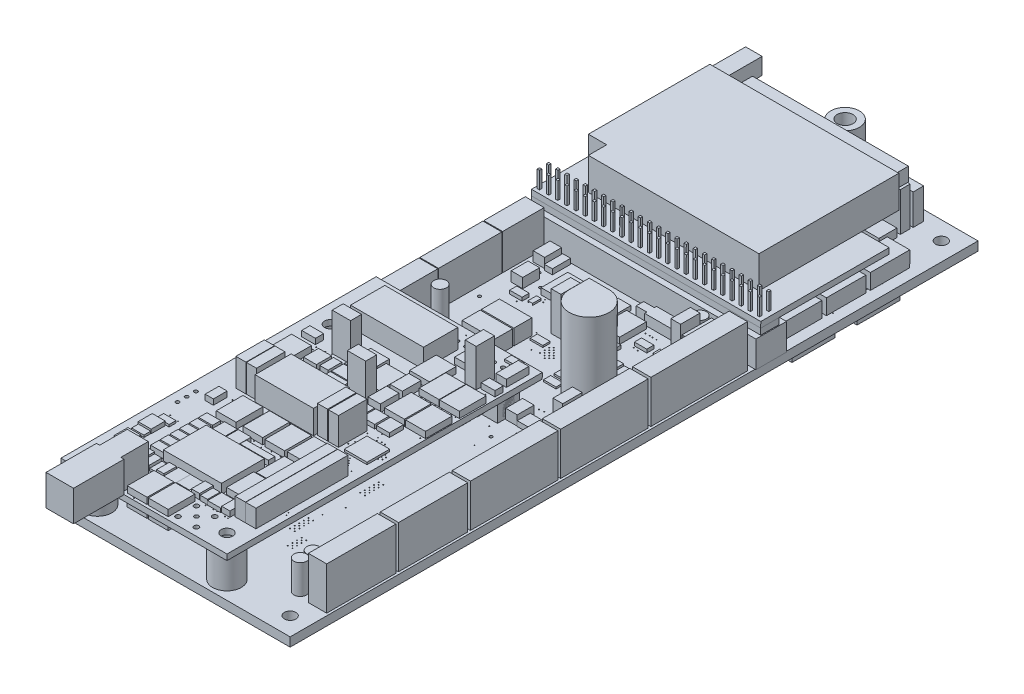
SolidWorks part; units mm, degrees
ref_plane "Front Plane" through (0, 0, 0) normal (0, 0, 1) x (1, 0, 0)
ref_plane "Top Plane" through (0, 0, 0) normal (0, 1, 0) x (1, 0, 0)
ref_plane "Right Plane" through (0, 0, 0) normal (1, 0, 0) x (0, 0, -1)
imported_body "CF2-1-solid1"
imported_body "PCB-pH2-10020553rc_SOLID-1-solid1"
imported_body "PCB-pH2-10020553rc_SOLID-1-surface1"
imported_body "PCB-pH2-10020553rc_SOLID-1-surface2"
imported_body "PCB-pH2-10020553rc_SOLID-1-surface3"
imported_body "PCB-pH2-10020553rc_SOLID-1-surface5"
imported_body "PCB-pH2-10020553rc_SOLID-1-surface6"
imported_body "PCB-pH2-10020553rc_SOLID-1-surface7"
imported_body "PCB-pH2-10020553rc_SOLID-1-surface8"
imported_body "PCB-pH2-10020553rc_SOLID-1-surface9"
imported_body "PCB-pH2-10020553rc_SOLID-1-surface10"
imported_body "PCB-pH2-10020553rc_SOLID-1-surface11"
imported_body "PCB-pH2-10020553rc_SOLID-1-surface12"
imported_body "PCB-pH2-10020553rc_SOLID-1-surface13"
imported_body "PCB-pH2-10020553rc_SOLID-1-surface14"
imported_body "PCB-pH2-10020553rc_SOLID-1-surface15"
imported_body "PCB-pH2-10020553rc_SOLID-1-surface16"
imported_body "PCB-pH2-10020553rc_SOLID-1-surface17"
imported_body "PCB-pH2-10020553rc_SOLID-1-surface18"
imported_body "PCB-pH2-10020553rc_SOLID-1-surface19"
imported_body "PCB-pH2-10020553rc_SOLID-1-surface20"
imported_body "PCB-pH2-10020553rc_SOLID-1-surface21"
imported_body "PCB-pH2-10020553rc_SOLID-1-surface22"
imported_body "PCB-pH2-10020553rc_SOLID-1-surface23"
imported_body "PCB-pH2-10020553rc_SOLID-1-surface24"
imported_body "PCB-pH2-10020553rc_SOLID-1-surface25"
imported_body "PCB-pH2-10020553rc_SOLID-1-surface26"
imported_body "PCB-pH2-10020553rc_SOLID-1-surface27"
imported_body "PCB-pH2-10020553rc_SOLID-1-surface28"
imported_body "PCB-pH2-10020553rc_SOLID-1-surface29"
imported_body "PCB-pH2-10020553rc_SOLID-1-surface30"
imported_body "PCB-pH2-10020553rc_SOLID-1-surface31"
imported_body "PCB-pH2-10020553rc_SOLID-1-surface32"
imported_body "PCB-pH2-10020553rc_SOLID-1-surface33"
imported_body "PCB-pH2-10020553rc_SOLID-1-surface34"
imported_body "PCB-pH2-10020553rc_SOLID-1-surface35"
imported_body "PCB-pH2-10020553rc_SOLID-1-surface36"
imported_body "PCB-pH2-10020553rc_SOLID-1-surface37"
imported_body "PCB-pH2-10020553rc_SOLID-1-surface38"
imported_body "PCB-pH2-10020553rc_SOLID-1-surface39"
imported_body "PCB-pH2-10020553rc_SOLID-1-surface40"
imported_body "PCB-pH2-10020553rc_SOLID-1-surface41"
imported_body "PCB-pH2-10020553rc_SOLID-1-surface42"
imported_body "PCB-pH2-10020553rc_SOLID-1-surface43"
imported_body "PCB-pH2-10020553rc_SOLID-1-surface44"
imported_body "PCB-pH2-10020553rc_SOLID-1-surface45"
imported_body "PCB-pH2-10020553rc_SOLID-1-surface46"
imported_body "PCB-pH2-10020553rc_SOLID-1-surface47"
imported_body "PCB-pH2-10020553rc_SOLID-1-surface48"
imported_body "PCB-pH2-10020553rc_SOLID-1-surface49"
imported_body "PCB-pH2-10020553rc_SOLID-1-surface50"
imported_body "PCB-pH2-10020553rc_SOLID-1-surface51"
imported_body "PCB-pH2-10020553rc_SOLID-1-surface52"
imported_body "PCB-pH2-10020553rc_SOLID-1-surface53"
imported_body "PCB-pH2-10020553rc_SOLID-1-surface54"
imported_body "PCB-pH2-10020553rc_SOLID-1-surface55"
imported_body "PCB-pH2-10020553rc_SOLID-1-surface56"
imported_body "PCB-pH2-10020553rc_SOLID-1-surface57"
imported_body "PCB-pH2-10020553rc_SOLID-1-surface58"
imported_body "PCB-pH2-10020553rc_SOLID-1-surface59"
imported_body "PCB-pH2-10020553rc_SOLID-1-surface60"
imported_body "PCB-pH2-10020553rc_SOLID-1-surface61"
imported_body "PCB-pH2-10020553rc_SOLID-1-surface62"
imported_body "PCB-pH2-10020553rc_SOLID-1-surface63"
imported_body "PCB-pH2-10020553rc_SOLID-1-surface64"
imported_body "PCB-pH2-10020553rc_SOLID-1-surface65"
imported_body "PCB-pH2-10020553rc_SOLID-1-surface66"
imported_body "PCB-pH2-10020553rc_SOLID-1-surface67"
imported_body "PCB-pH2-10020553rc_SOLID-1-surface68"
imported_body "PCB-pH2-10020553rc_SOLID-1-surface69"
imported_body "PCB-pH2-10020553rc_SOLID-1-surface70"
imported_body "PCB-pH2-10020553rc_SOLID-1-surface71"
imported_body "PCB-pH2-10020553rc_SOLID-1-surface72"
imported_body "PCB-pH2-10020553rc_SOLID-1-surface73"
imported_body "PCB-pH2-10020553rc_SOLID-1-surface74"
imported_body "PCB-pH2-10020553rc_SOLID-1-surface75"
imported_body "PCB-pH2-10020553rc_SOLID-1-surface76"
imported_body "PCB-pH2-10020553rc_SOLID-1-surface77"
imported_body "PCB-pH2-10020553rc_SOLID-1-surface78"
imported_body "PCB-pH2-10020553rc_SOLID-1-surface79"
imported_body "PCB-pH2-10020553rc_SOLID-1-surface80"
imported_body "PCB-pH2-10020553rc_SOLID-1-surface81"
imported_body "PCB-pH2-10020553rc_SOLID-1-surface82"
imported_body "PCB-pH2-10020553rc_SOLID-1-surface83"
imported_body "PCB-pH2-10020553rc_SOLID-1-surface84"
imported_body "PCB-pH2-10020553rc_SOLID-1-surface85"
imported_body "PCB-pH2-10020553rc_SOLID-1-surface86"
imported_body "PCB-pH2-10020553rc_SOLID-1-surface87"
imported_body "PCB-pH2-10020553rc_SOLID-1-surface88"
imported_body "PCB-pH2-10020553rc_SOLID-1-surface89"
imported_body "PCB-pH2-10020553rc_SOLID-1-surface90"
imported_body "PCB-pH2-10020553rc_SOLID-1-surface91"
imported_body "PCB-pH2-10020553rc_SOLID-1-surface92"
imported_body "PCB-pH2-10020553rc_SOLID-1-surface93"
imported_body "PCB-pH2-10020553rc_SOLID-1-surface94"
imported_body "PCB-pH2-10020553rc_SOLID-1-surface95"
imported_body "PCB-pH2-10020553rc_SOLID-1-surface96"
imported_body "PCB-pH2-10020553rc_SOLID-1-surface97"
imported_body "PCB-pH2-10020553rc_SOLID-1-surface98"
imported_body "PCB-pH2-10020553rc_SOLID-1-surface99"
imported_body "PCB-pH2-10020553rc_SOLID-1-surface100"
imported_body "PCB-pH2-10020553rc_SOLID-1-surface101"
imported_body "PCB-pH2-10020553rc_SOLID-1-surface102"
imported_body "PCB-pH2-10020553rc_SOLID-1-surface103"
imported_body "PCB-pH2-10020553rc_SOLID-1-surface104"
imported_body "PCB-pH2-10020553rc_SOLID-1-surface105"
imported_body "PCB-pH2-10020553rc_SOLID-1-surface106"
imported_body "PCB-pH2-10020553rc_SOLID-1-surface107"
imported_body "PCB-pH2-10020553rc_SOLID-1-surface108"
imported_body "PCB-pH2-10020553rc_SOLID-1-surface109"
imported_body "PCB-pH2-10020553rc_SOLID-1-surface110"
imported_body "PCB-pH2-10020553rc_SOLID-1-surface111"
imported_body "PCB-pH2-10020553rc_SOLID-1-surface112"
imported_body "PCB-pH2-10020553rc_SOLID-1-surface113"
imported_body "PCB-pH2-10020553rc_SOLID-1-surface114"
imported_body "PCB-pH2-10020553rc_SOLID-1-surface115"
imported_body "PCB-pH2-10020553rc_SOLID-1-surface116"
imported_body "PCB-pH2-10020553rc_SOLID-1-surface117"
imported_body "PCB-pH2-10020553rc_SOLID-1-surface118"
imported_body "PCB-pH2-10020553rc_SOLID-1-surface119"
imported_body "PCB-pH2-10020553rc_SOLID-1-surface120"
imported_body "PCB-pH2-10020553rc_SOLID-1-surface121"
imported_body "PCB-pH2-10020553rc_SOLID-1-surface122"
imported_body "PCB-pH2-10020553rc_SOLID-1-surface123"
imported_body "PCB-pH2-10020553rc_SOLID-1-surface124"
imported_body "PCB-pH2-10020553rc_SOLID-1-surface125"
imported_body "PCB-pH2-10020553rc_SOLID-1-surface126"
imported_body "PCB-pH2-10020553rc_SOLID-1-surface127"
imported_body "PCB-pH2-10020553rc_SOLID-1-surface128"
imported_body "PCB-pH2-10020553rc_SOLID-1-surface129"
imported_body "PCB-pH2-10020553rc_SOLID-1-surface130"
imported_body "PCB-pH2-10020553rc_SOLID-1-surface131"
imported_body "PCB-pH2-10020553rc_SOLID-1-surface132"
imported_body "PCB-pH2-10020553rc_SOLID-1-surface133"
imported_body "PCB-pH2-10020553rc_SOLID-1-surface134"
imported_body "PCB-pH2-10020553rc_SOLID-1-surface135"
imported_body "PCB-pH2-10020553rc_SOLID-1-surface136"
imported_body "PCB-pH2-10020553rc_SOLID-1-surface137"
imported_body "PCB-pH2-10020553rc_SOLID-1-surface138"
imported_body "PCB-pH2-10020553rc_SOLID-1-surface139"
imported_body "PCB-pH2-10020553rc_SOLID-1-surface140"
imported_body "PCB-pH2-10020553rc_SOLID-1-surface141"
imported_body "PCB-pH2-10020553rc_SOLID-1-surface142"
imported_body "PCB-pH2-10020553rc_SOLID-1-surface143"
imported_body "PCB-pH2-10020553rc_SOLID-1-surface144"
imported_body "PCB-pH2-10020553rc_SOLID-1-surface145"
imported_body "PCB-pH2-10020553rc_SOLID-1-surface146"
imported_body "PCB-pH2-10020553rc_SOLID-1-surface147"
imported_body "PCB-pH2-10020553rc_SOLID-1-surface148"
imported_body "PCB-pH2-10020553rc_SOLID-1-surface149"
imported_body "PCB-pH2-10020553rc_SOLID-1-surface150"
imported_body "PCB-pH2-10020553rc_SOLID-1-surface151"
imported_body "PCB-pH2-10020553rc_SOLID-1-surface152"
imported_body "PCB-pH2-10020553rc_SOLID-1-surface153"
imported_body "PCB-pH2-10020553rc_SOLID-1-surface154"
imported_body "PCB-pH2-10020553rc_SOLID-1-surface155"
imported_body "PCB-pH2-10020553rc_SOLID-1-surface156"
imported_body "PCB-pH2-10020553rc_SOLID-1-surface157"
imported_body "PCB-pH2-10020553rc_SOLID-1-surface158"
imported_body "PCB-pH2-10020553rc_SOLID-1-surface159"
imported_body "PCB-pH2-10020553rc_SOLID-1-surface160"
imported_body "PCB-pH2-10020553rc_SOLID-1-surface161"
imported_body "PCB-pH2-10020553rc_SOLID-1-surface162"
imported_body "PCB-pH2-10020553rc_SOLID-1-surface163"
imported_body "PCB-pH2-10020553rc_SOLID-1-surface164"
imported_body "PCB-pH2-10020553rc_SOLID-1-surface165"
imported_body "PCB-pH2-10020553rc_SOLID-1-surface166"
imported_body "PCB-pH2-10020553rc_SOLID-1-surface167"
imported_body "PCB-pH2-10020553rc_SOLID-1-surface168"
imported_body "PCB-pH2-10020553rc_SOLID-1-surface169"
imported_body "PCB-pH2-10020553rc_SOLID-1-surface170"
imported_body "PCB-pH2-10020553rc_SOLID-1-surface171"
imported_body "PCB-pH2-10020553rc_SOLID-1-surface172"
imported_body "PCB-pH2-10020553rc_SOLID-1-surface173"
imported_body "PCB-pH2-10020553rc_SOLID-1-surface174"
imported_body "PCB-pH2-10020553rc_SOLID-1-surface175"
imported_body "PCB-Cont2-10021035rb_SOLID_093-1-surface1"
ref_plane "Plane1" through (31.757, 0.0134, 0) normal (-1, -0.0004, 0) x (0, 0, 1)
imported_body "PCB-Cont2-10021035rb_SOLID_093-1-surface2"
imported_body "PCB-Cont2-10021035rb_SOLID_093-1-surface3"
imported_body "PCB-Cont2-10021035rb_SOLID_093-1-surface4"
imported_body "PCB-Cont2-10021035rb_SOLID_093-1-surface5"
imported_body "PCB-Cont2-10021035rb_SOLID_093-1-surface6"
imported_body "PCB-Cont2-10021035rb_SOLID_093-1-surface7"
imported_body "PCB-Cont2-10021035rb_SOLID_093-1-surface8"
imported_body "PCB-Cont2-10021035rb_SOLID_093-1-surface9"
imported_body "PCB-Cont2-10021035rb_SOLID_093-1-surface10"
imported_body "PCB-Cont2-10021035rb_SOLID_093-1-surface11"
imported_body "PCB-Cont2-10021035rb_SOLID_093-1-surface12"
imported_body "PCB-Cont2-10021035rb_SOLID_093-1-surface13"
imported_body "PCB-Cont2-10021035rb_SOLID_093-1-surface14"
imported_body "PCB-Cont2-10021035rb_SOLID_093-1-surface15"
imported_body "PCB-Cont2-10021035rb_SOLID_093-1-surface16"
imported_body "PCB-Cont2-10021035rb_SOLID_093-1-surface17"
imported_body "PCB-Cont2-10021035rb_SOLID_093-1-surface18"
imported_body "PCB-Cont2-10021035rb_SOLID_093-1-surface19"
imported_body "PCB-Cont2-10021035rb_SOLID_093-1-surface20"
imported_body "PCB-Cont2-10021035rb_SOLID_093-1-surface21"
imported_body "PCB-Cont2-10021035rb_SOLID_093-1-surface22"
imported_body "PCB-Cont2-10021035rb_SOLID_093-1-surface23"
imported_body "PCB-Cont2-10021035rb_SOLID_093-1-surface24"
imported_body "PCB-Cont2-10021035rb_SOLID_093-1-surface25"
imported_body "PCB-Cont2-10021035rb_SOLID_093-1-surface26"
imported_body "PCB-Cont2-10021035rb_SOLID_093-1-surface27"
imported_body "PCB-Cont2-10021035rb_SOLID_093-1-surface28"
imported_body "PCB-Cont2-10021035rb_SOLID_093-1-surface29"
imported_body "PCB-Cont2-10021035rb_SOLID_093-1-surface30"
imported_body "PCB-Cont2-10021035rb_SOLID_093-1-surface31"
imported_body "PCB-Cont2-10021035rb_SOLID_093-1-surface32"
imported_body "PCB-Cont2-10021035rb_SOLID_093-1-surface33"
imported_body "PCB-Cont2-10021035rb_SOLID_093-1-surface34"
imported_body "PCB-Cont2-10021035rb_SOLID_093-1-surface35"
imported_body "PCB-Cont2-10021035rb_SOLID_093-1-surface36"
imported_body "PCB-Cont2-10021035rb_SOLID_093-1-surface37"
imported_body "PCB-Cont2-10021035rb_SOLID_093-1-surface38"
imported_body "PCB-Cont2-10021035rb_SOLID_093-1-surface39"
imported_body "PCB-Cont2-10021035rb_SOLID_093-1-surface40"
imported_body "PCB-Cont2-10021035rb_SOLID_093-1-surface41"
imported_body "PCB-Cont2-10021035rb_SOLID_093-1-surface42"
imported_body "PCB-Cont2-10021035rb_SOLID_093-1-surface43"
imported_body "PCB-Cont2-10021035rb_SOLID_093-1-surface44"
imported_body "PCB-Cont2-10021035rb_SOLID_093-1-surface45"
imported_body "PCB-Cont2-10021035rb_SOLID_093-1-surface46"
imported_body "PCB-Cont2-10021035rb_SOLID_093-1-surface47"
imported_body "PCB-Cont2-10021035rb_SOLID_093-1-surface48"
imported_body "PCB-Cont2-10021035rb_SOLID_093-1-surface49"
imported_body "PCB-Cont2-10021035rb_SOLID_093-1-surface50"
imported_body "PCB-Cont2-10021035rb_SOLID_093-1-surface51"
imported_body "PCB-Cont2-10021035rb_SOLID_093-1-surface52"
imported_body "PCB-Cont2-10021035rb_SOLID_093-1-surface53"
imported_body "PCB-Cont2-10021035rb_SOLID_093-1-surface54"
imported_body "PCB-Cont2-10021035rb_SOLID_093-1-surface55"
imported_body "PCB-Cont2-10021035rb_SOLID_093-1-surface56"
imported_body "PCB-Cont2-10021035rb_SOLID_093-1-surface57"
imported_body "PCB-Cont2-10021035rb_SOLID_093-1-surface58"
imported_body "PCB-Cont2-10021035rb_SOLID_093-1-surface59"
imported_body "PCB-Cont2-10021035rb_SOLID_093-1-surface60"
imported_body "PCB-Cont2-10021035rb_SOLID_093-1-surface61"
imported_body "PCB-Cont2-10021035rb_SOLID_093-1-surface62"
imported_body "PCB-Cont2-10021035rb_SOLID_093-1-surface63"
imported_body "PCB-Cont2-10021035rb_SOLID_093-1-surface64"
imported_body "PCB-Cont2-10021035rb_SOLID_093-1-surface65"
imported_body "PCB-Cont2-10021035rb_SOLID_093-1-surface66"
imported_body "PCB-Cont2-10021035rb_SOLID_093-1-surface67"
imported_body "PCB-Cont2-10021035rb_SOLID_093-1-surface68"
imported_body "PCB-Cont2-10021035rb_SOLID_093-1-surface69"
imported_body "PCB-Cont2-10021035rb_SOLID_093-1-surface70"
imported_body "PCB-Cont2-10021035rb_SOLID_093-1-surface71"
imported_body "PCB-Cont2-10021035rb_SOLID_093-1-surface72"
imported_body "PCB-Cont2-10021035rb_SOLID_093-1-surface73"
imported_body "PCB-Cont2-10021035rb_SOLID_093-1-surface74"
imported_body "PCB-Cont2-10021035rb_SOLID_093-1-surface75"
imported_body "PCB-Cont2-10021035rb_SOLID_093-1-surface76"
imported_body "PCB-Cont2-10021035rb_SOLID_093-1-surface77"
imported_body "PCB-Cont2-10021035rb_SOLID_093-1-surface78"
imported_body "PCB-Cont2-10021035rb_SOLID_093-1-surface79"
imported_body "PCB-Cont2-10021035rb_SOLID_093-1-surface80"
imported_body "PCB-Cont2-10021035rb_SOLID_093-1-surface81"
imported_body "PCB-Cont2-10021035rb_SOLID_093-1-surface82"
imported_body "PCB-Cont2-10021035rb_SOLID_093-1-surface83"
imported_body "PCB-Cont2-10021035rb_SOLID_093-1-surface84"
imported_body "PCB-Cont2-10021035rb_SOLID_093-1-surface85"
imported_body "PCB-Cont2-10021035rb_SOLID_093-1-surface86"
imported_body "PCB-Cont2-10021035rb_SOLID_093-1-surface87"
imported_body "PCB-Cont2-10021035rb_SOLID_093-1-surface88"
imported_body "PCB-Cont2-10021035rb_SOLID_093-1-surface89"
imported_body "PCB-Cont2-10021035rb_SOLID_093-1-surface90"
imported_body "PCB-Cont2-10021035rb_SOLID_093-1-surface91"
imported_body "PCB-Cont2-10021035rb_SOLID_093-1-surface92"
imported_body "PCB-Cont2-10021035rb_SOLID_093-1-surface93"
imported_body "PCB-Cont2-10021035rb_SOLID_093-1-surface94"
imported_body "PCB-Cont2-10021035rb_SOLID_093-1-surface95"
imported_body "PCB-Cont2-10021035rb_SOLID_093-1-surface96"
imported_body "PCB-Cont2-10021035rb_SOLID_093-1-surface97"
imported_body "PCB-Cont2-10021035rb_SOLID_093-1-surface98"
imported_body "PCB-Cont2-10021035rb_SOLID_093-1-surface99"
imported_body "PCB-Cont2-10021035rb_SOLID_093-1-surface100"
imported_body "PCB-Cont2-10021035rb_SOLID_093-1-surface101"
imported_body "PCB-Cont2-10021035rb_SOLID_093-1-surface102"
imported_body "PCB-Cont2-10021035rb_SOLID_093-1-surface103"
imported_body "PCB-Cont2-10021035rb_SOLID_093-1-surface104"
imported_body "PCB-Cont2-10021035rb_SOLID_093-1-surface105"
imported_body "PCB-Cont2-10021035rb_SOLID_093-1-surface106"
imported_body "PCB-Cont2-10021035rb_SOLID_093-1-surface107"
imported_body "PCB-Cont2-10021035rb_SOLID_093-1-surface108"
imported_body "PCB-Cont2-10021035rb_SOLID_093-1-surface109"
imported_body "PCB-Cont2-10021035rb_SOLID_093-1-surface110"
imported_body "PCB-Cont2-10021035rb_SOLID_093-1-surface111"
imported_body "PCB-Cont2-10021035rb_SOLID_093-1-surface112"
imported_body "PCB-Cont2-10021035rb_SOLID_093-1-surface113"
imported_body "PCB-Cont2-10021035rb_SOLID_093-1-surface114"
imported_body "PCB-Cont2-10021035rb_SOLID_093-1-surface115"
imported_body "PCB-Cont2-10021035rb_SOLID_093-1-surface116"
imported_body "PCB-Cont2-10021035rb_SOLID_093-1-surface117"
imported_body "PCB-Cont2-10021035rb_SOLID_093-1-surface118"
imported_body "PCB-Cont2-10021035rb_SOLID_093-1-surface119"
imported_body "PCB-Cont2-10021035rb_SOLID_093-1-surface120"
imported_body "PCB-Cont2-10021035rb_SOLID_093-1-surface121"
imported_body "PCB-Cont2-10021035rb_SOLID_093-1-surface122"
imported_body "PCB-Cont2-10021035rb_SOLID_093-1-surface123"
imported_body "PCB-Cont2-10021035rb_SOLID_093-1-surface124"
imported_body "PCB-Cont2-10021035rb_SOLID_093-1-surface125"
imported_body "PCB-Cont2-10021035rb_SOLID_093-1-surface126"
imported_body "PCB-Cont2-10021035rb_SOLID_093-1-surface127"
imported_body "PCB-Cont2-10021035rb_SOLID_093-1-surface128"
imported_body "PCB-Cont2-10021035rb_SOLID_093-1-surface129"
imported_body "PCB-Cont2-10021035rb_SOLID_093-1-surface130"
imported_body "PCB-Cont2-10021035rb_SOLID_093-1-surface131"
imported_body "PCB-Cont2-10021035rb_SOLID_093-1-surface132"
imported_body "PCB-Cont2-10021035rb_SOLID_093-1-surface133"
imported_body "PCB-Cont2-10021035rb_SOLID_093-1-surface134"
imported_body "PCB-Cont2-10021035rb_SOLID_093-1-surface135"
imported_body "PCB-Cont2-10021035rb_SOLID_093-1-surface136"
imported_body "PCB-Cont2-10021035rb_SOLID_093-1-surface137"
imported_body "PCB-Cont2-10021035rb_SOLID_093-1-surface138"
imported_body "PCB-Cont2-10021035rb_SOLID_093-1-surface139"
imported_body "PCB-Cont2-10021035rb_SOLID_093-1-surface140"
imported_body "PCB-Cont2-10021035rb_SOLID_093-1-surface141"
imported_body "PCB-Cont2-10021035rb_SOLID_093-1-surface142"
imported_body "PCB-Cont2-10021035rb_SOLID_093-1-surface143"
imported_body "PCB-Cont2-10021035rb_SOLID_093-1-surface144"
imported_body "PCB-Cont2-10021035rb_SOLID_093-1-surface145"
imported_body "PCB-Cont2-10021035rb_SOLID_093-1-surface146"
imported_body "PCB-Cont2-10021035rb_SOLID_093-1-surface147"
imported_body "PCB-Cont2-10021035rb_SOLID_093-1-surface148"
imported_body "PCB-Cont2-10021035rb_SOLID_093-1-surface149"
imported_body "PCB-Cont2-10021035rb_SOLID_093-1-surface150"
imported_body "PCB-Cont2-10021035rb_SOLID_093-1-surface151"
imported_body "PCB-Cont2-10021035rb_SOLID_093-1-surface152"
imported_body "PCB-Cont2-10021035rb_SOLID_093-1-surface153"
imported_body "PCB-Cont2-10021035rb_SOLID_093-1-surface154"
imported_body "PCB-Cont2-10021035rb_SOLID_093-1-surface155"
imported_body "PCB-Cont2-10021035rb_SOLID_093-1-surface156"
imported_body "PCB-Cont2-10021035rb_SOLID_093-1-surface157"
imported_body "PCB-Cont2-10021035rb_SOLID_093-1-surface158"
imported_body "PCB-Cont2-10021035rb_SOLID_093-1-surface159"
imported_body "PCB-Cont2-10021035rb_SOLID_093-1-surface160"
imported_body "PCB-Cont2-10021035rb_SOLID_093-1-surface161"
imported_body "PCB-Cont2-10021035rb_SOLID_093-1-surface162"
imported_body "PCB-Cont2-10021035rb_SOLID_093-1-surface163"
imported_body "PCB-Cont2-10021035rb_SOLID_093-1-surface164"
imported_body "PCB-Cont2-10021035rb_SOLID_093-1-surface165"
imported_body "PCB-Cont2-10021035rb_SOLID_093-1-surface166"
imported_body "PCB-Cont2-10021035rb_SOLID_093-1-surface167"
imported_body "PCB-Cont2-10021035rb_SOLID_093-1-surface168"
imported_body "PCB-Cont2-10021035rb_SOLID_093-1-surface169"
imported_body "PCB-Cont2-10021035rb_SOLID_093-1-surface170"
imported_body "PCB-Cont2-10021035rb_SOLID_093-1-surface171"
imported_body "PCB-Cont2-10021035rb_SOLID_093-1-surface172"
imported_body "PCB-Cont2-10021035rb_SOLID_093-1-surface173"
imported_body "PCB-Cont2-10021035rb_SOLID_093-1-surface174"
imported_body "PCB-Cont2-10021035rb_SOLID_093-1-surface175"
imported_body "PCB-Cont2-10021035rb_SOLID_093-1-surface176"
imported_body "PCB-Cont2-10021035rb_SOLID_093-1-surface177"
imported_body "PCB-Cont2-10021035rb_SOLID_093-1-surface178"
imported_body "PCB-Cont2-10021035rb_SOLID_093-1-surface179"
imported_body "PCB-Cont2-10021035rb_SOLID_093-1-surface180"
imported_body "PCB-Cont2-10021035rb_SOLID_093-1-surface181"
imported_body "PCB-Cont2-10021035rb_SOLID_093-1-surface182"
imported_body "PCB-Cont2-10021035rb_SOLID_093-1-surface183"
imported_body "PCB-Cont2-10021035rb_SOLID_093-1-surface184"
imported_body "PCB-Cont2-10021035rb_SOLID_093-1-surface185"
imported_body "PCB-Cont2-10021035rb_SOLID_093-1-surface186"
imported_body "pcb-10021088ra_SOLID-1-surface4"
imported_body "pcb-10021088ra_SOLID-1-surface5"
imported_body "pcb-10021088ra_SOLID-1-surface6"
imported_body "pcb-10021088ra_SOLID-1-surface7"
imported_body "pcb-10021088ra_SOLID-1-surface9"
imported_body "pcb-10021088ra_SOLID-1-surface11"
imported_body "pcb-10021088ra_SOLID-1-surface13"
imported_body "pcb-10021088ra_SOLID-1-surface15"
imported_body "pcb-10021088ra_SOLID-1-surface16"
imported_body "pcb-10021088ra_SOLID-1-surface17"
imported_body "pcb-10021088ra_SOLID-1-surface19"
imported_body "pcb-10021088ra_SOLID-1-surface20"
imported_body "pcb-10021088ra_SOLID-1-surface21"
imported_body "pcb-10021088ra_SOLID-1-surface22"
imported_body "pcb-10021088ra_SOLID-1-surface23"
imported_body "pcb-10021088ra_SOLID-1-surface24"
imported_body "pcb-10021088ra_SOLID-1-surface25"
imported_body "pcb-10021088ra_SOLID-1-surface26"
imported_body "pcb-10021088ra_SOLID-1-surface28"
imported_body "Spacer-12-solid1"
imported_body "CPUsupportAssy-1/93090A210-1-solid1"
imported_body "CPUsupportAssy-1/93090A210-2-solid1"
imported_body "CPUsupportAssy-1/93090A210-4-solid1"
imported_body "Spacer-17-solid1"
imported_body "Pan Head Phillips (U.S.)-15-solid1"
imported_body "CF2holder-1-solid1"
imported_body "Spacer-25-solid1"
imported_body "Spacer-37-solid1"
imported_body "Spacer-38-solid1"
imported_body "Spacer-39-solid1"
imported_body "Pan Head Phillips (U.S.)-31-solid1"
imported_body "Pan Head Phillips (U.S.)-32-solid1"
imported_body "Spacer-40-solid1"
sketch "Sketch1" plane through (-0.0001, 0.3025, 204.5565) normal (0, 0.0015, 1) x (1, 0, 0)
  line L4 (13.7143, 20.6095) -> (13.7143, 16.3429) construction
  line L5 (9.9043, 20.6079) -> (17.5243, 20.6111) construction
  line L6 (9.9061, 16.3429) -> (13.7143, 16.3429) construction
  line L7 (9.9043, 20.6079) -> (9.9079, 12.0779) construction
  line L9 (9.9043, 20.6079) -> (17.5279, 20.6079)
  line L10 (9.9043, 20.6079) -> (9.9043, 12.0811)
  line L11 (9.9043, 12.0811) -> (17.5279, 12.0811)
  line L12 (17.5279, 20.6079) -> (17.5279, 12.0811)
  circle A0 centre (13.7143, 16.3429) radius 3.3614
extrude "Cut-Extrude1" cut sketch "Sketch1" against normal blind 7.62 flip side to cut
delete or keep bodies "Body-Delete/Keep 1" bodies 478
